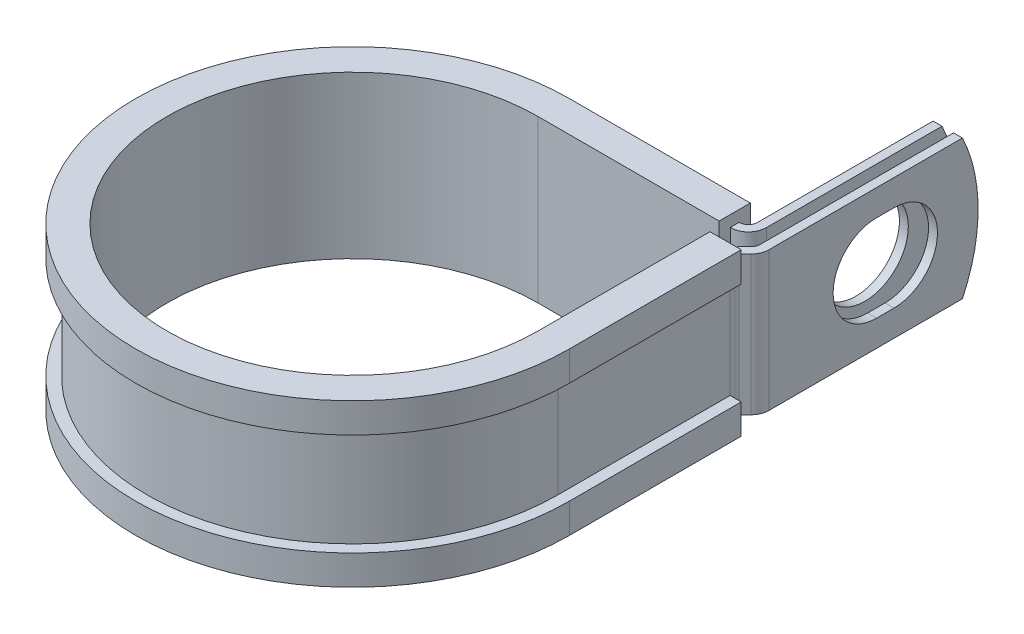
SolidWorks part; units mm, degrees
ref_plane "Front Plane" through (0, 0, 0) normal (0, 0, 1) x (1, 0, 0)
ref_plane "Top Plane" through (0, 0, 0) normal (0, 1, 0) x (1, 0, 0)
ref_plane "Right Plane" through (0, 0, 0) normal (1, 0, 0) x (0, 0, -1)
sketch "Sketch1" plane through (0, 0, 0) normal (0, 1, 0) x (1, 0, 0)
  line L0 (0, 26.924) -> (24.8083, 26.924)
  line L1 (26.924, 0) -> (26.924, 23.5115)
  line L2 (27.2467, 55.5498) -> (27.2467, 29.3624)
  line L3 (27.6382, 25.2357) -> (28.4644, 26.0619)
  line L5 (28.8215, 26.924) -> (28.8215, 55.5498)
  arc A0 (0, 26.924) -> (26.924, 0) centre (0, 0) ccw
  arc A1 (27.6382, 25.2357) -> (26.924, 23.5115) centre (29.3624, 23.5115) ccw
  arc A2 (28.4644, 26.0619) -> (28.8215, 26.924) centre (27.6023, 26.924) ccw
  arc A3 (24.8083, 26.924) -> (27.2467, 29.3624) centre (24.8083, 29.3624) ccw
extrude "Extrude-Thin1" add sketch "Sketch1" along normal mid plane 19.05 thin
sketch "Sketch2" plane through (26.0275, 0, 0) normal (-1, 0, 0) x (0, 0, 1)
  line L0 (-55.5498, 9.525) -> (-55.5498, -9.525) construction
  line L1 (0, 9.525) -> (0, -9.525) construction
  circle A0 centre (-42.8498, 0) radius 5.9436
  point P2 (-55.5498, 0)
extrude "Cut-Extrude1" cut sketch "Sketch2" against normal up to surface (1.2192 mm away)
sketch "Sketch3" plane through (30.0407, 0, 0) normal (1, 0, 0) x (0, 0, -1)
  line L0 (41.656, 0) -> (44.0436, 0) construction
  line L1 (41.656, 5.9436) -> (44.0436, 5.9436)
  line L2 (41.656, -5.9436) -> (44.0436, -5.9436)
  line L3 (55.5498, 9.525) -> (55.5498, -9.525) construction
  arc A0 (41.656, 5.9436) -> (41.656, -5.9436) centre (41.656, 0) ccw
  arc A1 (44.0436, -5.9436) -> (44.0436, 5.9436) centre (44.0436, 0) ccw
  point P3 (42.8498, 0)
  point P8 (55.5498, 0)
  point P11 (35.7124, 0)
  point P12 (49.9872, 0)
extrude "Cut-Extrude2" cut sketch "Sketch3" against normal up to surface (1.2192 mm away)
sketch "Sketch4" plane through (26.0275, 0, 0) normal (-1, 0, 0) x (0, 0, 1)
  line L0 (-55.5498, 9.525) -> (-55.5498, -9.525)
  line L1 (-55.5498, 9.525) -> (-53.4053, 9.525)
  line L2 (-55.5498, 9.525) -> (-29.3624, 9.525) construction
  line L3 (-55.5498, -9.525) -> (-53.4053, -9.525)
  line L4 (-55.5498, -9.525) -> (-29.3624, -9.525) construction
  arc A0 (-53.4053, 9.525) -> (-53.4053, -9.525) centre (-33.3248, 0) ccw
extrude "Cut-Extrude3" cut sketch "Sketch4" against normal through all contours A0 M4 M5 | A0 L0 M2
ref_plane "Plane1" through (0, 0, -23.5115) normal (0, 0, -1) x (-1, 0, 0)
ref_plane "Plane2" through (24.7575, 0, 0) normal (-1, 0, 0) x (0, 0, 1)
sketch "Sketch5" plane through (0, 0, -23.5115) normal (0, 0, -1) x (-1, 0, 0)
  line L0 (-28.1432, 9.525) -> (-26.924, 9.525)
  line L1 (-28.1432, 9.525) -> (-28.1432, -9.525) construction
  line L3 (-26.924, 9.525) -> (-26.924, -9.525)
  line L4 (-26.924, -9.525) -> (-28.1432, -9.525)
  line L5 (-28.1432, -9.525) -> (-28.1432, -6.985)
  line L6 (-28.1432, 9.525) -> (-28.1432, 6.985)
  line L7 (-29.6672, 11.049) -> (-29.6672, 6.985)
  line L8 (-29.6672, 11.049) -> (-25.4, 11.049)
  line L9 (-25.4, 11.049) -> (-25.4, -11.049)
  line L10 (-25.4, -11.049) -> (-29.6672, -11.049)
  line L11 (-29.6672, -11.049) -> (-29.6672, -6.985)
  line L12 (-29.6672, 6.985) -> (-28.1432, 6.985)
  line L13 (-28.1432, -6.985) -> (-29.6672, -6.985)
sketch "Sketch6" plane through (0, 9.525, 0) normal (0, 1, 0) x (1, 0, 0)
  line L0 (25.4, 0) -> (25.4, 23.5115)
  line L1 (25.4, 23.5115) -> (29.6672, 23.5115) construction
  line L2 (24.7575, 6.9878) -> (24.7575, -6.9878) construction
  line L5 (0, 25.4) -> (24.7575, 25.4)
  arc A0 (0, 25.4) -> (25.4, 0) centre (0, 0) ccw
sweep "Sweep1" add profiles "Sketch5" path "Sketch6"
equation "\"D4@Sketch5\" = \"D1@Extrude-Thin1\""
equation "\"D5@Sketch5\" = \"D5@Extrude-Thin1\""
equation "\"D1@Sketch3\" = \"D2@Sketch2\""
equation "\"D7@Sketch1\" = \"D3@Sketch2\" + \"D1@Sketch3\""
equation "\"D1@Sketch1\" = \"D1@Sketch6\" + 2 * \"D3@Sketch5\""
equation "\"D1@Sketch4\" = ( \"D1@Extrude-Thin1\" + .125 ) * 2"
equation "\"D9@Sketch1\"= \"D5@Extrude-Thin1\""
equation "\"D8@Sketch1\"= 2 * \"D5@Extrude-Thin1\""
equation "\"D2@Sketch1\" = 2 * \"D5@Extrude-Thin1\""
equation "\"D2@Sketch3\" = \"D1@Sketch2\""
